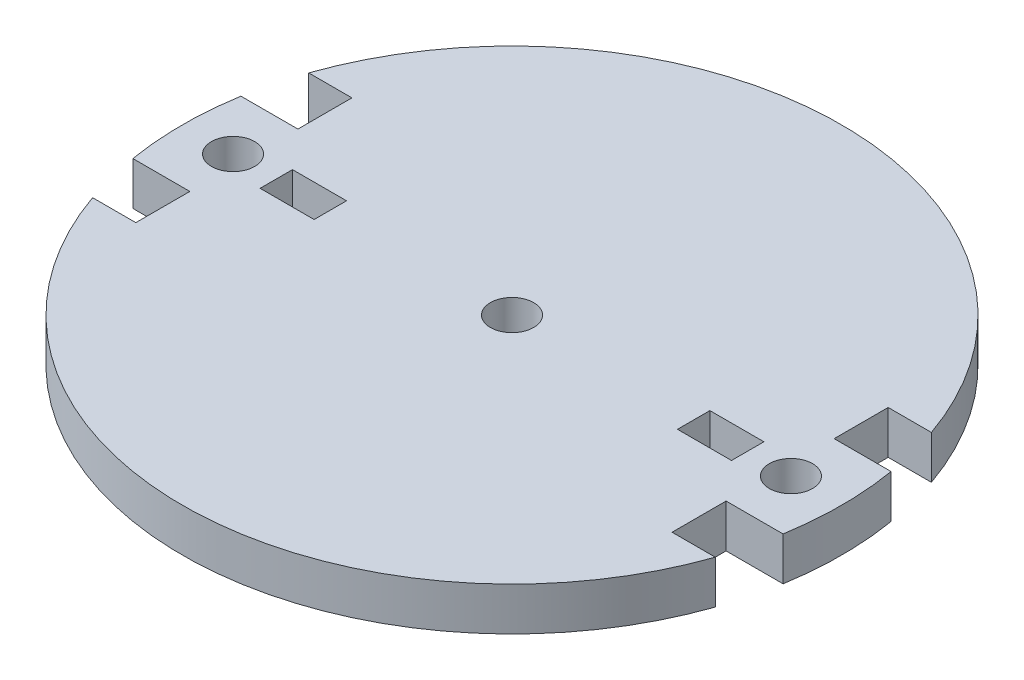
SolidWorks part; units mm, degrees
ref_plane "Alzado" through (0, 0, 0) normal (0, 0, 1) x (1, 0, 0)
ref_plane "Planta" through (0, 0, 0) normal (0, 1, 0) x (1, 0, 0)
ref_plane "Vista lateral" through (0, 0, 0) normal (1, 0, 0) x (0, 0, -1)
sketch "Croquis1" plane through (0, 0, 0) normal (0, 1, 0) x (1, 0, 0)
  circle A0 centre (0, 0) radius 30.5
extrude "Saliente-Extruir1" add sketch "Croquis1" along normal blind 4
sketch "Croquis2" plane through (0, 4, 0) normal (0, 1, 0) x (1, 0, 0)
  circle A0 centre (0, 0) radius 2
extrude "Cortar-Extruir1" cut sketch "Croquis2" against normal blind 4
sketch "Croquis5" plane through (0, 4, 0) normal (0, 1, 0) x (1, 0, 0)
  line L0 (0, 0) -> (0, 10)
  line L1 (28.8141, -5) -> (30.0874, -5)
  line L2 (28.8141, 5) -> (30.0874, 5)
  line L3 (-24.8141, 10) -> (-28.8141, 10)
  line L4 (24.8141, -5) -> (24.8141, -10)
  line L5 (-24.8141, -10) -> (-28.8141, -10)
  line L6 (24.8141, -5) -> (28.8141, -5)
  line L7 (24.8141, 5) -> (24.8141, 10)
  line L8 (-24.8141, 5) -> (-28.8141, 5)
  line L9 (-24.8141, 5) -> (-24.8141, 10)
  line L10 (-24.8141, -5) -> (-28.8141, -5)
  line L11 (-24.8141, -5) -> (-24.8141, -10)
  line L12 (24.8141, 5) -> (28.8141, 5)
  line L13 (24.8141, -10) -> (28.8141, -10)
  line L14 (24.8141, 10) -> (28.8141, 10)
  line L15 (-28.8141, 5) -> (-30.0874, 5)
  line L16 (-28.8141, -5) -> (-30.0874, -5)
  circle A1 centre (0, 0) radius 30.5 construction
  arc A2 (-28.8141, 10) -> (-30.0874, 5) centre (0, 0) ccw
  arc A3 (28.8141, 10) -> (28.8141, -10) centre (0, 0) cw
  arc A4 (-30.0874, -5) -> (-28.8141, -10) centre (0, 0) ccw
  arc A5 (30.0874, -5) -> (28.8141, -10) centre (0, 0) cw
  arc A6 (28.8141, 10) -> (30.0874, 5) centre (0, 0) cw
extrude "Cortar-Extruir3" cut sketch "Croquis5" against normal blind 4
sketch "Croquis6" plane through (0, 4, 0) normal (0, 1, 0) x (1, 0, 0)
  line L0 (16.8141, 1.5) -> (21.8141, 1.5)
  line L1 (-16.8141, 1.5) -> (-16.8141, -1.5)
  line L2 (-16.8141, -1.5) -> (-21.8141, -1.5)
  line L3 (-21.8141, -1.5) -> (-21.8141, 1.5)
  line L5 (-16.8141, 1.5) -> (-21.8141, 1.5)
  line L6 (21.8141, -1.5) -> (21.8141, 1.5)
  line L7 (16.8141, -1.5) -> (21.8141, -1.5)
  line L8 (16.8141, 1.5) -> (16.8141, -1.5)
extrude "Cortar-Extruir4" cut sketch "Croquis6" against normal blind 4
sketch "Croquis7" plane through (0, 4, 0) normal (0, 1, 0) x (1, 0, 0)
  circle A1 centre (-25.8141, 0) radius 2
  circle A2 centre (25.8141, 0) radius 2
extrude "Cortar-Extruir5" cut sketch "Croquis7" against normal blind 4
